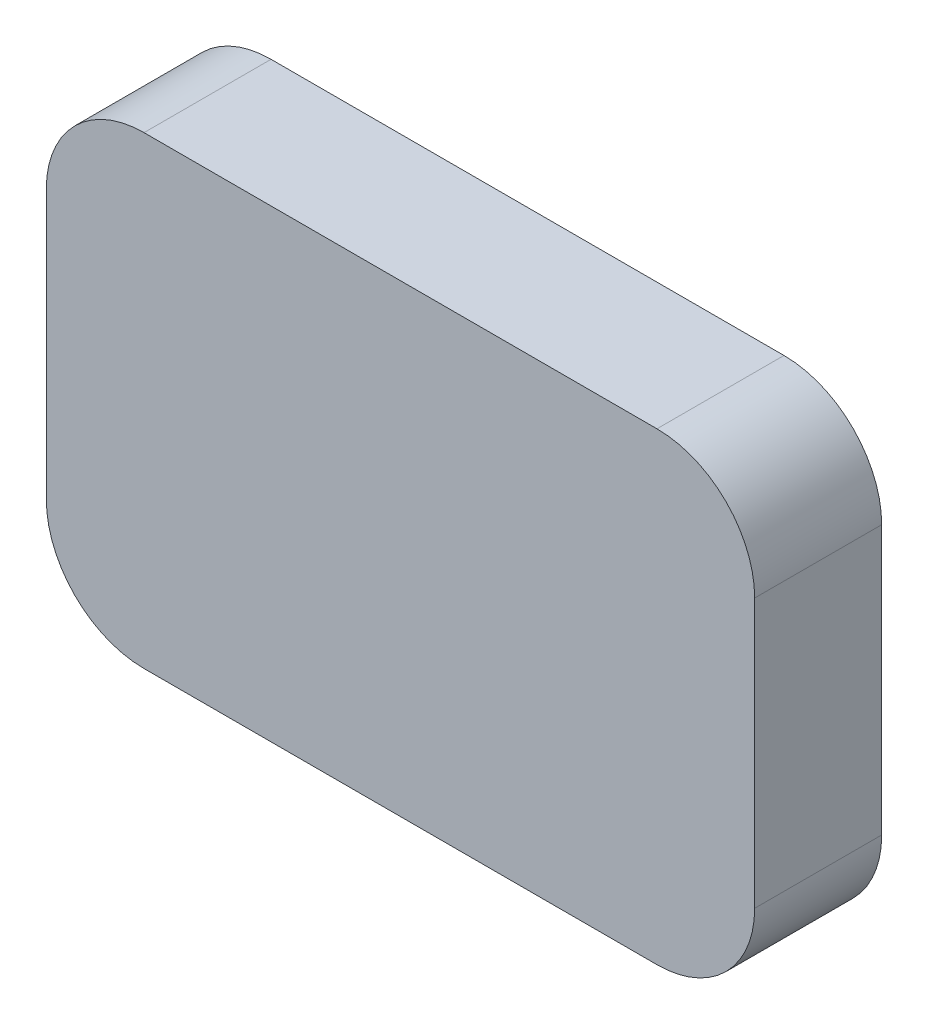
SolidWorks part; units mm, degrees
ref_plane "Plan de face" through (0, 0, 0) normal (0, 0, 1) x (1, 0, 0)
ref_plane "Plan de dessus" through (0, 0, 0) normal (0, 1, 0) x (1, 0, 0)
ref_plane "Plan de droite" through (0, 0, 0) normal (1, 0, 0) x (0, 0, -1)
sketch "Esquisse1" plane through (0, 0, 0) normal (0, 0, 1) x (1, 0, 0)
  line L1 (20, 0) -> (125, 0)
  line L2 (0, 20) -> (0, 75)
  line L3 (20, 95) -> (125, 95)
  line L4 (145, 20) -> (145, 75)
  arc A0 (0, 75) -> (20, 95) centre (20, 75) cw
  arc A1 (20, 0) -> (0, 20) centre (20, 20) cw
  arc A2 (145, 20) -> (125, 0) centre (125, 20) cw
  arc A3 (125, 95) -> (145, 75) centre (125, 75) cw
  point P7 (0, 95)
  point P10 (0, 0)
  point P13 (145, 0)
  point P16 (145, 95)
  dimension "D3" = 20
  dimension "D1" = 145
  dimension "D2" = 95
extrude "Extrusion1" add sketch "Esquisse1" along normal blind 26
sketch "Esquisse2"
